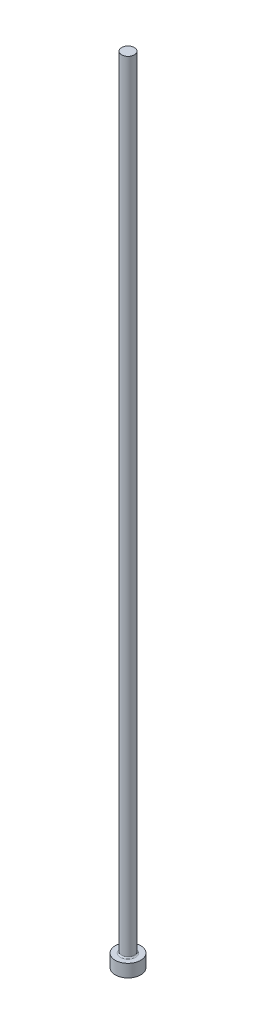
SolidWorks part; units mm, degrees
ref_plane "Plano frontal" through (0, 0, 0) normal (0, 0, 1) x (1, 0, 0)
ref_plane "Plano superior" through (0, 0, 0) normal (0, 1, 0) x (1, 0, 0)
ref_plane "Plano direito" through (0, 0, 0) normal (1, 0, 0) x (0, 0, -1)
sketch "Esboço1" plane through (0, 0, 0) normal (0, 0, 1) x (1, 0, 0)
  line L0 (0, 0) -> (2, 0)
  line L1 (2, 0) -> (2, 2)
  line L2 (2, 2) -> (1.2, 2)
  line L3 (1, 2.2) -> (1, 125)
  line L4 (1, 125) -> (0, 125)
  line L5 (0, 125) -> (0, 0) construction
  line L6 (0, 0) -> (0, 125)
  arc A0 (1.2, 2) -> (1, 2.2) centre (1.2, 2.2) cw
  dimension "D3" = 0.2
  dimension "D1" = 4
  dimension "D2" = 2
  dimension "D4" = 2
  dimension "D5" = 125
revolve "Revolução1" add sketch "Esboço1" angle 360 about L5
sketch "Esboço2"
  dimension "D1" = 1.075
  dimension "D2" = 0.35
  dimension "D3" = 0.225
  dimension "D4" = 0.15
wrap "Envolver1" sketch "Esboço2" wrap type deboss source sketch "Esboço2" thickness 0.1 parameters "D1"=0.1
